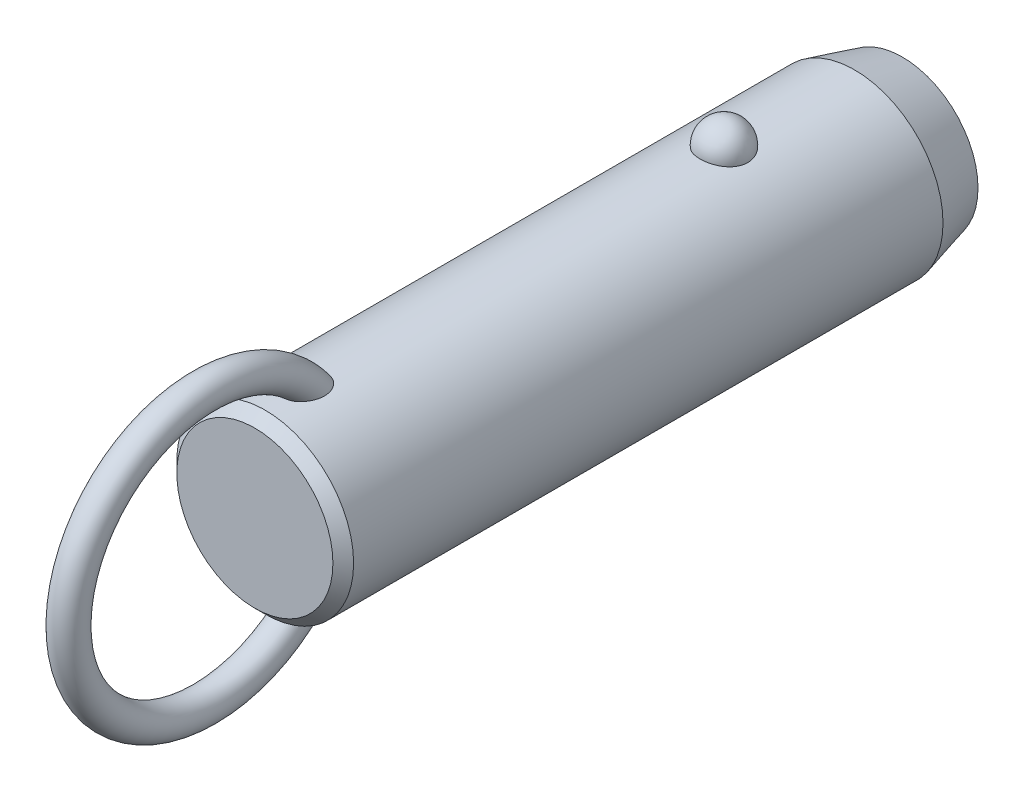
SolidWorks part; units mm, degrees
ref_plane "Front Plane" through (0, 0, 0) normal (0, 0, 1) x (1, 0, 0)
ref_plane "Top Plane" through (0, 0, 0) normal (0, 1, 0) x (1, 0, 0)
ref_plane "Right Plane" through (0, 0, 0) normal (1, 0, 0) x (0, 0, -1)
sketch "Sketch2" plane through (0, 0, 0) normal (0, 0, 1) x (1, 0, 0)
  circle A0 centre (0, 0) radius 11.1
  point P3 (0, 11.1)
  dimension "D1" = 22.2
extrude "Boss-Extrude1" add sketch "Sketch2" along normal blind 43.2
sketch "Sketch3" plane through (0, 0, 0) normal (0, 0, -1) x (-1, 0, 0)
  circle A0 centre (0, 0) radius 11.1
  dimension "D1" = 22.2
extrude "Boss-Extrude2" add sketch "Sketch3" along normal blind 25.4
chamfer "Chamfer1" distance 6 angle 15 1 edges at (-11.1, 0, -25.4)
sketch "Sketch12" plane through (0, 0, 0) normal (1, 0, 0) x (0, 0, -1)
  line L0 (-43.2, 11.1) -> (-43.2, -11.1) construction
  point P0 (-43.2, 0)
sketch "Sketch13" plane through (0, 0, 0) normal (1, 0, 0) x (0, 0, -1)
  circle A0 centre (-62.25, 0) radius 19.05
  point P2 (-43.2, 0)
  dimension "D1" = 38.1
sketch "Sketch14" plane through (0, 0, 0) normal (0, 1, 0) x (1, 0, 0)
  circle A0 centre (0, -45.2) radius 2
  point P2 (0, -43.2)
  dimension "D1" = 4
sweep "Sweep1" add profiles "Sketch14" path "Sketch13"
sketch "Sketch15" plane through (0, 0, 43.2) normal (0, 0, 1) x (1, 0, 0)
  circle A0 centre (0, 0) radius 11.1
  dimension "D1" = 22.2
extrude "Boss-Extrude3" add sketch "Sketch15" along normal blind 12.7
chamfer "Chamfer2" distance 1.3 angle 45 1 edges at (11.1, 0, 55.9)
sketch "Sketch18" plane through (0, 0, 0) normal (1, 0, 0) x (0, 0, -1)
  line L0 (19.4, 11.1) -> (-46.768, 11.1) construction
  line L1 (3, 14.1) -> (3, 8.1)
  line L2 (-46.768, -11.1) -> (19.4, -11.1) construction
  arc A0 (3, 14.1) -> (3, 8.1) centre (3, 11.1) ccw
  point P4 (0, 11.1)
  dimension "D1" = 25.2
revolve "Revolve1" add sketch "Sketch18" angle 360 about L1
